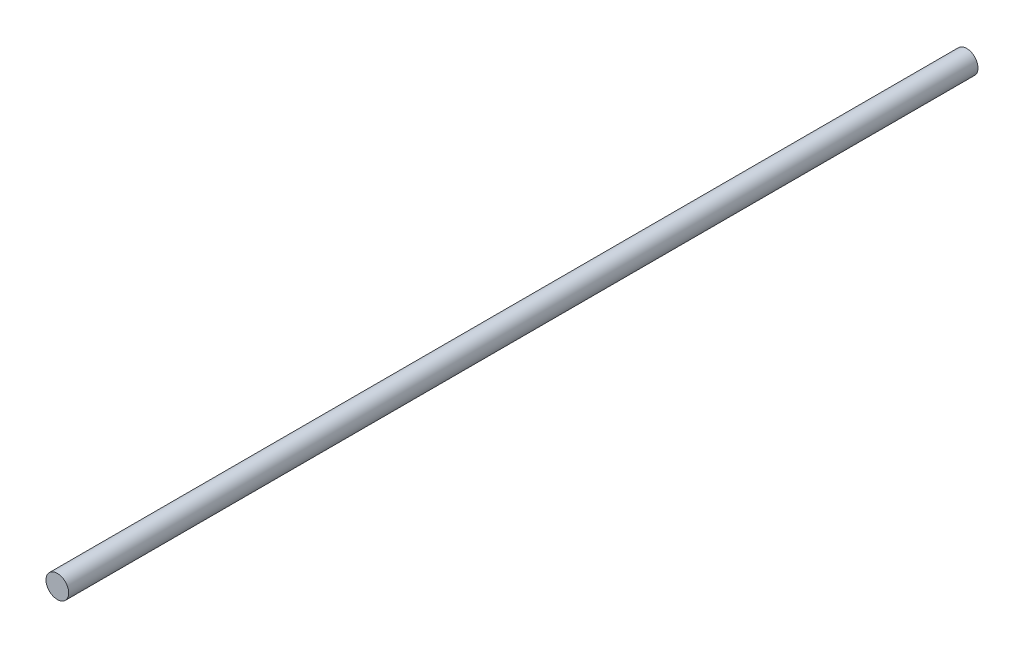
SolidWorks part; units mm, degrees
ref_plane "Front Plane" through (0, 0, 0) normal (0, 0, 1) x (1, 0, 0)
ref_plane "Top Plane" through (0, 0, 0) normal (0, 1, 0) x (1, 0, 0)
ref_plane "Right Plane" through (0, 0, 0) normal (1, 0, 0) x (0, 0, -1)
sketch "Sketch1" plane through (0, 0, 0) normal (0, 0, 1) x (1, 0, 0)
  circle A0 centre (0, 0) radius 30
  dimension "D1" = 60
extrude "Boss-Extrude1" add sketch "Sketch1" against normal blind 2400
